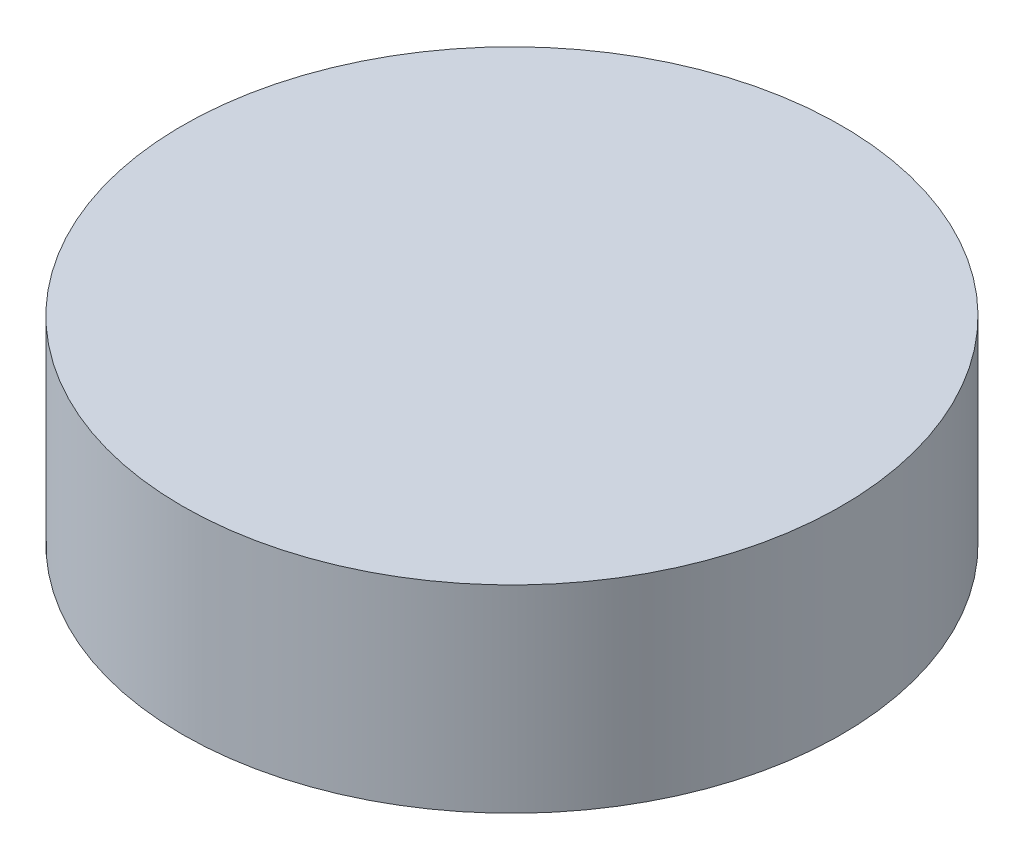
SolidWorks part; units mm, degrees
ref_plane "Front Plane" through (0, 0, 0) normal (0, 0, 1) x (1, 0, 0)
ref_plane "Top Plane" through (0, 0, 0) normal (0, 1, 0) x (1, 0, 0)
ref_plane "Right Plane" through (0, 0, 0) normal (1, 0, 0) x (0, 0, -1)
other "Configuration Table"
sketch "草图1" plane through (0, 0, 0) normal (0, 1, 0) x (1, 0, 0)
  circle A0 centre (0, 0) radius 5
  dimension "D1" = 10
extrude "凸台-拉伸1" add sketch "草图1" along normal blind 3
